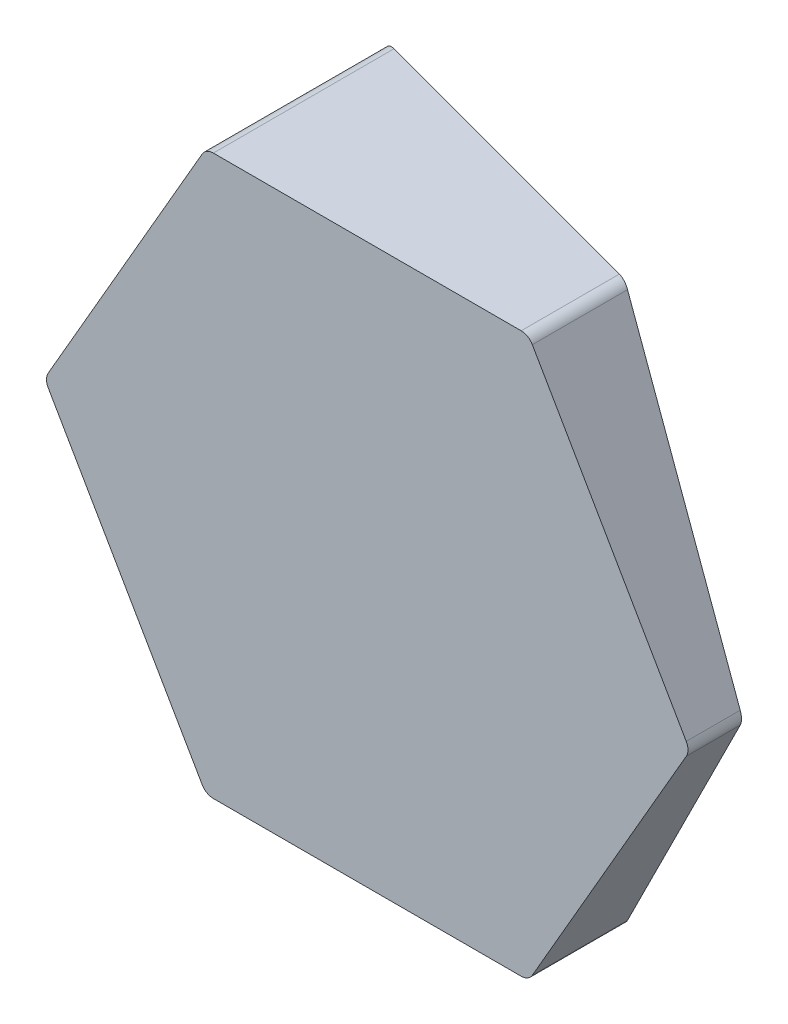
SolidWorks part; units mm, degrees
ref_plane "Front Plane" through (0, 0, 0) normal (0, 0, 1) x (1, 0, 0)
ref_plane "Top Plane" through (0, 0, 0) normal (0, 1, 0) x (1, 0, 0)
ref_plane "Right Plane" through (0, 0, 0) normal (1, 0, 0) x (0, 0, -1)
sketch "Sketch1" plane through (0, 0, 0) normal (0, 0, 1) x (1, 0, 0)
  line L0 (0, 0) -> (50, 0) construction
  line L1 (50, 0) -> (25, 43.3013)
  line L2 (25, 43.3013) -> (-25, 43.3013)
  line L3 (-25, 43.3013) -> (-50, 0)
  line L4 (-50, 0) -> (-25, -43.3013)
  line L5 (-25, -43.3013) -> (25, -43.3013)
  line L6 (25, -43.3013) -> (50, 0)
  circle A0 centre (0, 0) radius 43.3013 construction
  dimension "D1" = 100
extrude "Boss-Extrude1" add sketch "Sketch1" along normal blind 35
sketch "Sketch2" plane through (0, 0, 0) normal (0, 1, 0) x (1, 0, 0)
  line L0 (-50, 0) -> (50, -26.7949)
  line L1 (-47.6314, 0) -> (47.6314, 0) construction
  line L4 (50, -26.7949) -> (50, 0)
  line L5 (50, 0) -> (-50, 0)
  dimension "D1" = 15
extrude "Cut-Extrude1" cut sketch "Sketch2" against normal through all and the other way through all
sketch "Sketch3" plane through (-3.3494, 0, 12.5) normal (0.2588, 0, -0.9659) x (-0.9659, 0, -0.2588)
  line L0 (-3.4675, 43.3013) -> (-3.4675, -43.3013) construction
  line L1 (22.4144, 43.3013) -> (-29.3494, 43.3013) construction
  line L2 (22.4144, -43.3013) -> (-29.3494, -43.3013) construction
  line L3 (-55.2313, 0) -> (48.2963, 0) construction
  circle A0 centre (-3.4675, 0) radius 17.5
  dimension "D1" = 35
extrude "Cut-Extrude2" [suppressed] cut sketch "Sketch3" against normal blind 6
hole_wizard "M4x0.7 Tapped Hole1" positions "Sketch6" profile "Sketch5" tap size "M4x0.7" standard "ANSI Metric"
sketch "Sketch6" [suppressed] plane through (-3.3494, 0, 12.5) normal (0.2588, 0, -0.9659) x (-0.9659, 0, -0.2588)
  line L0 (-3.4675, 0) -> (-3.4675, 25) construction
  point P0 (-3.4675, 25)
  point P16 (14.2102, 17.6777)
  point P17 (21.5325, 0)
  point P18 (14.2102, -17.6777)
  point P19 (-3.4675, -25)
  point P20 (-21.1452, -17.6777)
  point P21 (-28.4675, 0)
  point P22 (-21.1452, 17.6777)
  dimension "D1" = 25
  dimension "D2" = 8
sketch "Sketch5" plane through (0, 25, 13.3975) normal (0, 1, 0) x (-0.9659, 0, -0.2588)
  line L0 (0, 0) -> (0, 12.4914)
  line L1 (0, 12.4914) -> (1.65, 11.5)
  line L2 (1.65, 11.5) -> (1.65, 0.375)
  line L3 (1.65, 0.375) -> (2.025, 0)
  line L5 (2.025, 0) -> (0, 0)
  line L6 (-1.65, 0.375) -> (-2.025, 0) construction
  line L10 (0, 12.4914) -> (-1.65, 11.5) construction
  line L11 (0, -6.35) -> (0, 107.95) construction
  dimension "Tap Drill Dia." = 3.3
  dimension "Tap Drill Depth" = 11.5
  dimension "Near C'Sink Dia." = 4.05
  dimension "Near C'Sink Angle" = 90
  dimension "Drill Angle" = 118
fillet "Fillet2" radius 2 6 edges at (-25, 43.3013, 20.8494) (25, 43.3013, 27.5481) (-50, 0, 17.5) (-25, -43.3013, 20.8494) (25, -43.3013, 27.5481) (50, 0, 30.8975)
sketch "Sketch7" [suppressed] plane through (0, 0, 0) normal (0, 1, 0) x (1, 0, 0)
  line L0 (-1.5529, -19.193) -> (-4.1842, -29.0131) construction
  line L1 (15.3508, -23.7223) -> (-18.4566, -14.6637) construction
hole_wizard "CBORE for M4 SHCS1" positions "Sketch8" profile "Sketch9" counterbore size "M4" standard "ANSI Metric"
sketch "Sketch8" [suppressed] plane through (-3.3494, 0, 12.5) normal (0.2588, 0, -0.9659) x (-0.9659, 0, -0.2588)
  line L0 (-3.4675, 0) -> (38.8998, 0) construction
  line L1 (-3.4675, 0) -> (-3.4675, 43.3013) construction
  line L2 (21.219, 43.3013) -> (-28.154, 43.3013) construction
  line L3 (-3.4675, 0) -> (-43.4675, 0) construction
  line L4 (-3.4675, 0) -> (-3.4675, -35) construction
  point P0 (-43.4675, 0)
  point P20 (-3.4675, 35)
  point P22 (-3.4675, -35)
  point P29 (31.5325, 0)
  dimension "D1" = 40
  dimension "D2" = 35
  dimension "D3" = 35
  dimension "D4" = 35
sketch "Sketch9" plane through (38.637, 0, 23.7502) normal (0, 1, 0) x (-0.9659, 0, -0.2588)
  line L0 (0, 0) -> (0, 12.8519)
  line L1 (0, 12.8519) -> (2.25, 11.5)
  line L2 (2.25, 11.5) -> (2.25, 4)
  line L3 (2.25, 4) -> (4, 4)
  line L5 (4, 4) -> (4, 0.025)
  line L6 (4, 0.025) -> (4.025, 0)
  line L7 (4.025, 0) -> (0, 0)
  line L8 (-4, 0.025) -> (-4.025, 0) construction
  line L10 (0, 12.8519) -> (-2.25, 11.5) construction
  line L11 (0, -6.35) -> (0, 107.95) construction
  dimension "Hole Dia." = 4.5
  dimension "Hole Depth" = 11.5
  dimension "C'Bore Dia." = 8
  dimension "C'Bore Depth" = 4
  dimension "Near C'Sink Dia." = 8.05
  dimension "Near C'Sink Angle" = 90
  dimension "Drill Angle" = 118
